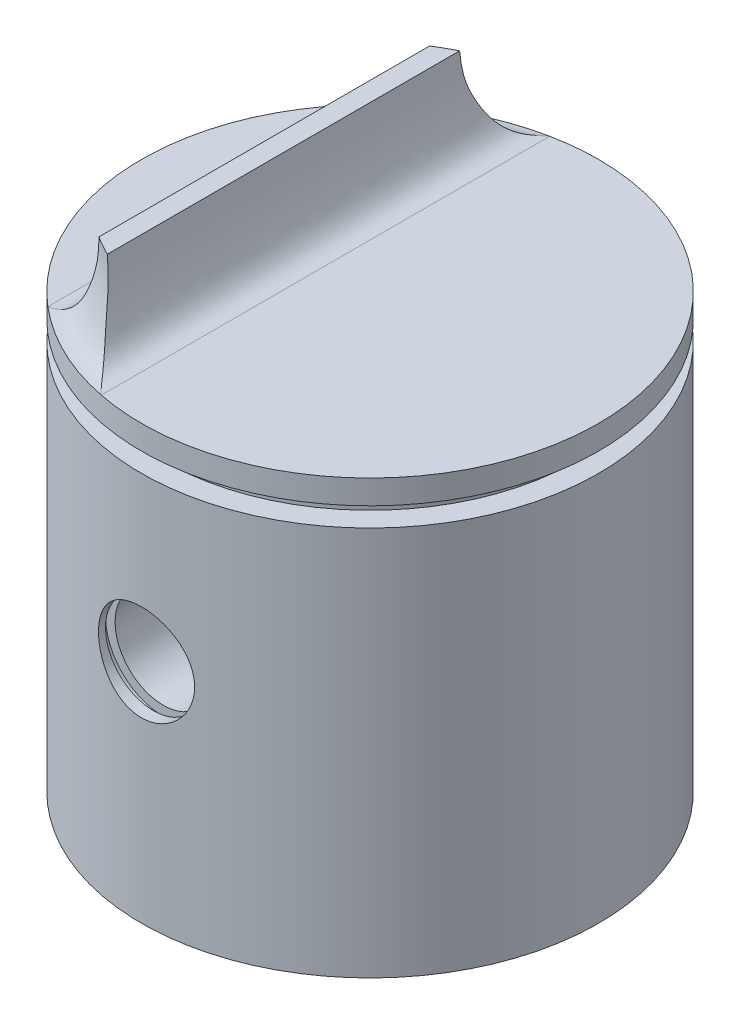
SolidWorks part; units mm, degrees
ref_plane "Plan1" through (0, 0, 0) normal (0, 0, 1) x (1, 0, 0)
ref_plane "Plan2" through (0, 0, 0) normal (0, 1, 0) x (1, 0, 0)
ref_plane "Plan3" through (0, 0, 0) normal (1, 0, 0) x (0, 0, -1)
sketch "Esquisse1" plane through (0, 0, 0) normal (0, 0, 1) x (1, 0, 0)
  line L0 (0, 0) -> (0, 54.7) construction
  line L1 (-10.5, 0) -> (-11.88, 0)
  line L2 (-11.88, 0) -> (-11.88, 20.25)
  line L4 (-11.88, 20.25) -> (-10.75, 20.25)
  line L6 (-10.75, 20.25) -> (-10.75, 21.25)
  line L7 (0, 6.75) -> (-10.5, 6.75)
  line L8 (-10.75, 21.25) -> (-11.88, 21.25)
  line L9 (-10.5, 6.75) -> (-10.5, 0)
  line L10 (-11.88, 21.25) -> (-11.88, 22.5)
  line L12 (-11.88, 22.5) -> (0, 22.5)
  line L13 (0, 22.5) -> (0, 6.75)
  point P16 (0, 22.5)
  dimension "D1" = 10.5
  dimension "D2" = 11.88
  dimension "D4" = 1
  dimension "D5" = 1.13
  dimension "D6" = 1.25
  dimension "D7" = 22.5
  dimension "D8" = 6.75
revolve "Base-Révolution" add sketch "Esquisse1" angle 360 about L0
sketch "Esquisse2" plane through (0, 0, 0) normal (0, 0, 1) x (1, 0, 0)
  line L0 (14, 11.75) -> (-13.4, 11.75) construction
  line L3 (11, 14.25) -> (-11, 14.25)
  line L4 (-11, 14.25) -> (-11, 14.75)
  line L5 (11, 14.25) -> (11, 14.5)
  line L6 (-11, 14.75) -> (-11.5, 14.75)
  line L7 (11, 14.5) -> (11.5, 14.5)
  line L8 (-11.5, 14.75) -> (-11.5, 14.25)
  line L9 (11.5, 14.5) -> (11.5, 14.25)
  line L10 (-11.5, 14.25) -> (-11.8826, 14.25)
  line L11 (11.5, 14.25) -> (11.88, 14.25)
  line L13 (11.88, 14.25) -> (11.88, 11.75)
  line L15 (-11.88, 11.75) -> (-11.8826, 14.25)
  line L16 (-11.88, 11.75) -> (11.88, 11.75)
  dimension "D1" = 2.5
  dimension "D2" = 3
  dimension "D3" = 11.75
  dimension "D4" = 0.5
  dimension "D5" = 11
  dimension "D6" = 11
  dimension "D7" = 0.5
sketch "Esquisse3" plane through (0, 0, 0) normal (0, 0, 1) x (1, 0, 0)
  line L0 (-5.5, 26.5) -> (-4.5, 26.5)
  line L1 (11.88, 22.5) -> (-11.88, 22.5) construction
  line L2 (-5, 27.5) -> (-5, 22.7) construction
  line L3 (-2.315, 22.5) -> (-7.685, 22.5)
  spline_without_curve S0
  spline_without_curve S1
  point P13 (-5, 26.5)
  dimension "D1" = 0.5
  dimension "D2" = 5.37
  dimension "D3" = 4
  dimension "D4" = 0.9988
  dimension "D5" = 2.098
  dimension "D6" = 5
extrude "Boss.-Extru.1" add sketch "Esquisse3" along normal up to surface and the other way up to surface
sketch "Esquisse8" plane through (0, 6.75, 0) normal (0, -1, 0) x (1, 0, 0)
  circle A0 centre (0, 0) radius 9.75
  dimension "D1" = 19.5
extrude "Enlèv. mat.-Extru.3" cut sketch "Esquisse8" against normal blind 11.75
sketch "Esquisse9" plane through (0, 18.5, 0) normal (0, -1, 0) x (1, 0, 0)
  circle A0 centre (0, 0) radius 8.5
  dimension "D1" = 17
extrude "Enlèv. mat.-Extru.4" cut sketch "Esquisse9" against normal blind 2.25
sketch "Esquisse10" plane through (0, 20.75, 0) normal (0, -1, 0) x (1, 0, 0)
  line L0 (-13.8, 0) -> (13.7, 0) construction
  line L2 (-4.75, 8.5147) -> (-4.75, 5.5)
  line L3 (-4.75, 5.5) -> (4.75, 5.5)
  line L4 (4.75, 8.5147) -> (4.75, 5.5)
  line L5 (4.75, -8.5147) -> (4.75, -5.5)
  line L7 (-4.75, -8.5147) -> (-4.75, -5.5)
  line L8 (-4.75, -5.5) -> (4.75, -5.5)
  circle A0 centre (0, 0) radius 9.75 construction
  arc A1 (-4.75, -8.5147) -> (4.75, -8.5147) centre (0, 0) ccw
  arc A2 (4.75, 8.5147) -> (-4.75, 8.5147) centre (0, 0) ccw
  dimension "D4" = 9.5
  dimension "D1" = 9.5
  dimension "D2" = 5.5
  dimension "D3" = 4.75
extrude "Boss.-Extru.2" add sketch "Esquisse10" along normal up to surface (14 mm away)
sketch "Esquisse4" plane through (0, 0, 0) normal (1, 0, 0) x (0, 0, -1)
  line L0 (0, 0) -> (0, 27.7701) construction
  line L1 (0, 22.5) -> (0, 21.25) construction
  line L2 (11.88, 22.5) -> (-11.88, 22.5) construction
  line L3 (15.2, 22.5) -> (11.88, 22.5)
  line L7 (15.2, 26.5) -> (15.2, 22.5)
  line L9 (10.2, 26.5) -> (15.2, 26.5)
  spline_without_curve S1
revolve "Enlèvement de matière-Révolution2" cut sketch "Esquisse4" angle 360 about L0
sketch "Esquisse5" plane through (0, 0, 0) normal (1, 0, 0) x (0, 0, -1)
  line L2 (14.1026, 11.75) -> (-13.2974, 11.75) construction
  line L3 (10.75, 14.25) -> (-10.75, 14.25)
  line L4 (-10.75, 14.25) -> (-10.75, 14.75)
  line L5 (10.75, 14.25) -> (10.75, 14.5)
  line L6 (-10.75, 14.75) -> (-11.25, 14.75)
  line L7 (10.75, 14.5) -> (11.25, 14.5)
  line L8 (-11.25, 14.75) -> (-11.25, 14.25)
  line L9 (11.25, 14.5) -> (11.25, 14.25)
  line L10 (-11.25, 14.25) -> (-11.9008, 14.25)
  line L11 (11.25, 14.25) -> (11.88, 14.25)
  line L13 (-11.8981, 11.75) -> (-11.9008, 14.25)
  line L14 (-11.8981, 11.75) -> (11.88, 11.75)
  line L15 (-11.88, 0) -> (11.88, 0) construction
  line L16 (11.88, 20.25) -> (11.88, 0)
  line L17 (11.88, 14.25) -> (11.88, 11.75)
  line L18 (-11.88, 0) -> (-11.88, 20.25)
  dimension "D1" = 11.75
  dimension "D2" = 2.5
  dimension "D3" = 3
  dimension "D4" = 0.5
  dimension "D5" = 0.5
  dimension "D6" = 10.75
  dimension "D7" = 10.75
revolve "Enlèvement de matière-Révolution3" cut sketch "Esquisse5" angle 360 about L2
sketch "Esquisse11" plane through (0, 20.75, 0) normal (0, -1, 0) x (1, 0, 0)
  line L0 (4.75, -5.5) -> (6.4807, -5.5)
  line L1 (-4.75, 5.5) -> (-6.4807, 5.5)
  line L6 (-4.75, -7.0489) -> (-4.75, -5.5)
  line L7 (-4.75, -5.5) -> (4.75, -5.5)
  line L8 (4.75, -5.5) -> (4.75, -7.0489)
  line L9 (4.75, 7.0489) -> (4.75, 5.5)
  line L10 (4.75, 5.5) -> (-4.75, 5.5)
  line L11 (-4.75, 5.5) -> (-4.75, 7.0489)
  line L12 (-4.75, -7.0489) -> (-4.75, -5.5)
  line L13 (-6.4807, -5.5) -> (-4.75, -5.5)
  line L14 (4.75, -5.5) -> (4.75, -7.0489)
  line L15 (4.75, 7.0489) -> (4.75, 5.5)
  line L16 (6.4807, 5.5) -> (4.75, 5.5)
  line L17 (-4.75, 5.5) -> (-4.75, 7.0489)
  arc A0 (6.4807, 5.5) -> (4.75, 7.0489) centre (0, 0) ccw
  arc A1 (-6.4807, -5.5) -> (-4.75, -7.0489) centre (0, 0) ccw
  arc A2 (-4.75, 7.0489) -> (-4.75, -7.0489) centre (0, 0) ccw
  arc A3 (4.75, -7.0489) -> (4.75, 7.0489) centre (0, 0) ccw
  arc A4 (-4.75, 7.0489) -> (-6.4807, 5.5) centre (0, 0) ccw
  arc A5 (4.75, -7.0489) -> (6.4807, -5.5) centre (0, 0) ccw
  dimension "D1" = 0
extrude "Boss.-Extru.3" add sketch "Esquisse11" along normal up to surface (2.25 mm away)
fillet "Congé1" radius 1
fillet "Congé8" radius 1
fillet "Congé9" radius 1
fillet "Congé10" radius 1
fillet "Congé11" radius 1
fillet "Congé13" radius 1
fillet "Congé14" radius 1
fillet "Congé15" radius 1
